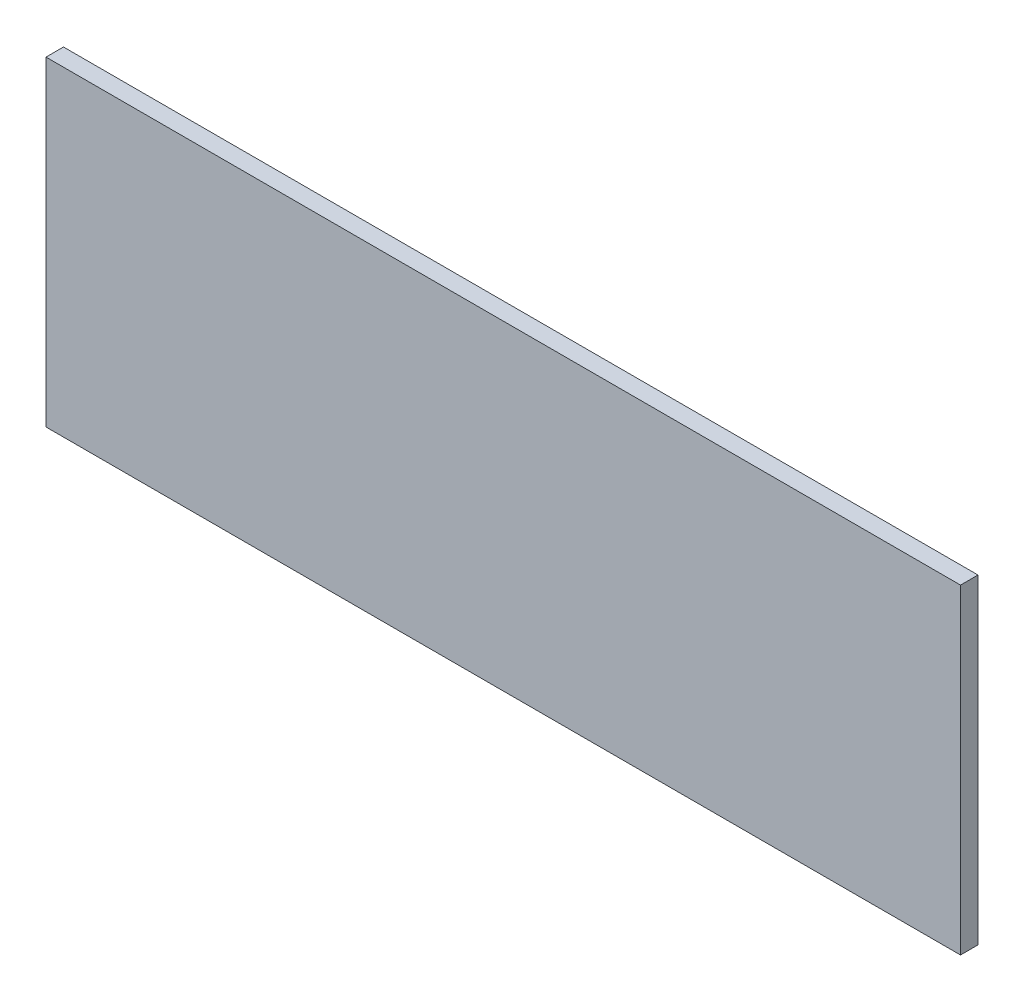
SolidWorks part; units mm, degrees
ref_plane "Front Plane" through (0, 0, 0) normal (0, 0, 1) x (1, 0, 0)
ref_plane "Top Plane" through (0, 0, 0) normal (0, 1, 0) x (1, 0, 0)
ref_plane "Right Plane" through (0, 0, 0) normal (1, 0, 0) x (0, 0, -1)
sketch "Sketch1" plane through (0, 0, 0) normal (0, 0, 1) x (1, 0, 0)
  line L1 (-47.1026, 14.813) -> (32.6534, 14.813)
  line L2 (-47.1026, 14.813) -> (-47.1026, -13.127)
  line L3 (-47.1026, -13.127) -> (32.6534, -13.127)
  line L4 (32.6534, 14.813) -> (32.6534, -13.127)
  dimension "D1" = 79.756
  dimension "D2" = 27.94
extrude "Extrude1" add sketch "Sketch1" along normal blind 1.524
sketch "Sketch2" plane through (0, 0, 1.524) normal (0, 0, 1) x (1, 0, 0)
  text T0 "Analog Board"
